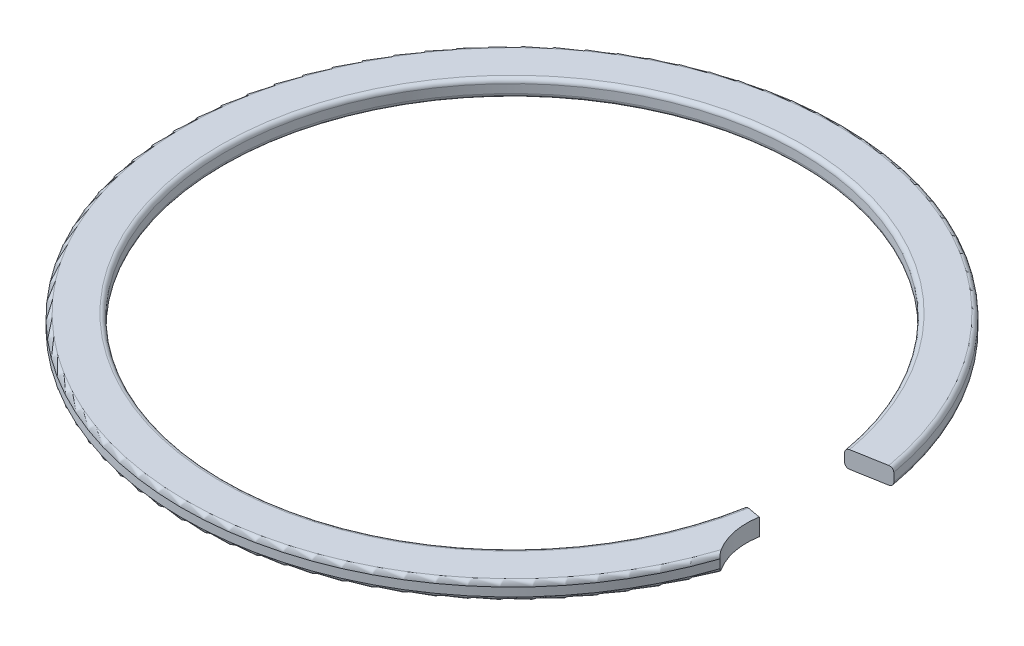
SolidWorks part; units mm, degrees
ref_plane "Front Plane" through (0, 0, 0) normal (0, 0, 1) x (1, 0, 0)
ref_plane "Top Plane" through (0, 0, 0) normal (0, 1, 0) x (1, 0, 0)
ref_plane "Right Plane" through (0, 0, 0) normal (1, 0, 0) x (0, 0, -1)
ref_plane "Plane4" through (0, 0, 0) normal (0, 0, 1) x (1, 0, 0)
sketch "Sketch1" plane through (0, 0, 0) normal (0, 0, 1) x (1, 0, 0)
  line L0 (7.72, 0.115) -> (7.72, -0.115)
  line L1 (7.835, -0.23) -> (8.745, -0.23)
  line L2 (8.86, -0.115) -> (8.86, 0.115)
  line L3 (8.745, 0.23) -> (7.835, 0.23)
  line L4 (0, -0.46) -> (0, 0.46) construction
  arc A0 (7.72, -0.115) -> (7.835, -0.23) centre (7.835, -0.115) ccw
  arc A1 (8.745, -0.23) -> (8.86, -0.115) centre (8.745, -0.115) ccw
  arc A2 (8.86, 0.115) -> (8.745, 0.23) centre (8.745, 0.115) ccw
  arc A3 (7.835, 0.23) -> (7.72, 0.115) centre (7.835, 0.115) ccw
  dimension "D1" = 15.44
  dimension "D2" = 17.72
  dimension "D3" = 0.46
revolve "Revolve1" add sketch "Sketch1" angle 360 about L4
ref_plane "Plane5" through (0, 0, 0) normal (0, 1, 0) x (-1, 0, 0)
sketch "Sketch2" plane through (0, 0, 0) normal (0, 1, 0) x (-1, 0, 0)
  line L0 (0, 0) -> (-8.0705, 1.423)
  line L1 (-9.5979, -1.6924) -> (0, 0)
  arc A0 (-8.0705, 1.423) -> (-9.1356, 3.3949) centre (-9.8481, 1.7365) ccw
  arc A1 (-9.1356, 3.3949) -> (-9.5979, -1.6924) centre (0, 0) ccw
extrude "Extrude1" cut sketch "Sketch2" against normal blind 0.46 and the other way blind 0.46
